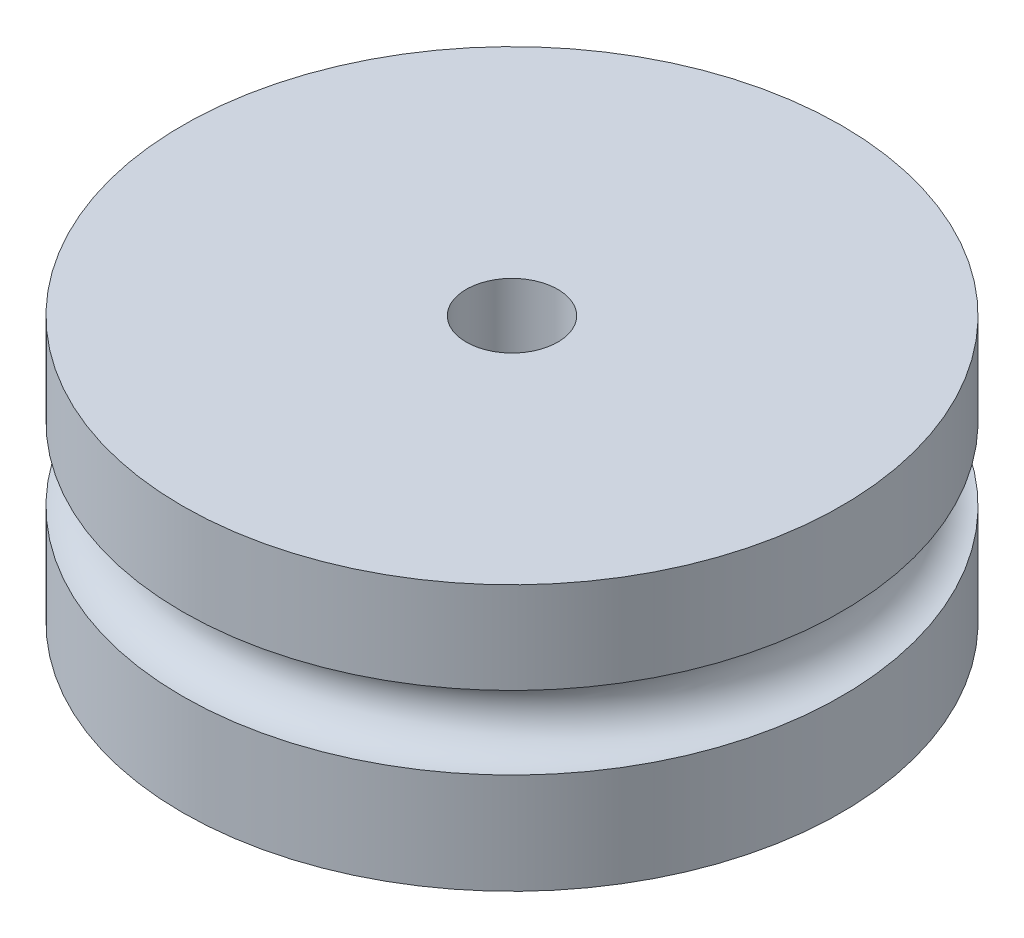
SolidWorks part; units mm, degrees
ref_plane "Front" through (0, 0, 0) normal (0, 0, 1) x (1, 0, 0)
ref_plane "Top" through (0, 0, 0) normal (0, 1, 0) x (1, 0, 0)
ref_plane "Right" through (0, 0, 0) normal (1, 0, 0) x (0, 0, -1)
sketch "Sketch1" plane through (0, 0, 0) normal (0, 1, 0) x (1, 0, 0)
  circle A0 centre (0, 0) radius 18
  dimension "D1" = 36
extrude "Boss-Extrude1" add sketch "Sketch1" along normal mid plane 14.5
sketch "Sketch2" plane through (0, 0, 0) normal (0, 0, 1) x (1, 0, 0)
  line L1 (-18, -7.25) -> (18, -7.25) construction
  line L2 (-18, 7.25) -> (-18, -7.25) construction
  circle A0 centre (-18, 0.25) radius 2
  dimension "D1" = 4
  dimension "D2" = 7.5
revolve "Cut-Revolve1" cut sketch "Sketch2" angle 360 about axis through (0, 7.25, 0) along (0, -1, 0)
hole_wizard "Ø5.0mm Dowel Hole1" positions "Sketch3" profile "Sketch4" hole size "Ø5.0" standard "ANSI Metric"
sketch "Sketch3" plane through (0, 7.25, 0) normal (0, 1, 0) x (1, 0, 0)
  point P0 (0, 0)
sketch "Sketch4" plane through (0, 7.25, 0) normal (1, 0, 0) x (0, 0, 1)
  line L0 (0, 0) -> (0, 14.5)
  line L1 (0, 14.5) -> (2.5, 14.5)
  line L2 (2.5, 14.5) -> (2.5, 0)
  line L5 (2.5, 0) -> (0, 0)
  line L11 (0, -6.35) -> (0, 107.95) construction
  dimension "Thru Hole Dia." = 5
  dimension "Thru Hole Depth" = 14.5
hole_wizard "M3x0.5 Tapped Hole1" positions "3DSketch1" profile "Sketch5" tap size "M3x0.5" standard "ANSI Metric"
sketch3d "3DSketch1"
  line L0 (0, 7.25, 0) -> (0, 2.25, 0) construction
  line L1 (0, 0, 0) -> (0, 4.75, 0) construction
  line L2 (0, 4.75, 0) -> (0, 4.75, 18) construction
  point P0 (0, 14.6251, 0)
  point P5 (0, 4.75, 18)
  dimension "D1" = 4.75
sketch "Sketch5" plane through (0, 4.75, 18) normal (1, 0, 0) x (0, -1, 0)
  line L0 (0, 0) -> (0, 18.7511)
  line L1 (0, 18.7511) -> (1.25, 18)
  line L2 (1.25, 18) -> (1.25, 0)
  line L5 (1.25, 0) -> (0, 0)
  line L10 (0, 18.7511) -> (-1.25, 18) construction
  line L11 (0, -6.35) -> (0, 107.95) construction
  dimension "Tap Drill Dia." = 2.5
  dimension "Tap Drill Depth" = 18
  dimension "Drill Angle" = 118
mirror "Mirror1" [suppressed] about plane through (0, 0, 0) normal (0, 1, 0)
hole_wizard "Ø5.0mm Dowel Hole2" positions "Sketch8" profile "Sketch7" hole size "Ø5.0" standard "ANSI Metric"
sketch "Sketch8" plane through (0, 7.25, 0) normal (0, 1, 0) x (1, 0, 0)
  point P0 (0, 0)
sketch "Sketch7" plane through (0, 7.25, 0) normal (1, 0, 0) x (0, 0, 1)
  line L0 (0, 0) -> (0, 14.5)
  line L1 (0, 14.5) -> (2.5, 14.5)
  line L2 (2.5, 14.5) -> (2.5, 0)
  line L5 (2.5, 0) -> (0, 0)
  line L11 (0, -6.35) -> (0, 107.95) construction
  dimension "Thru Hole Dia." = 5
  dimension "Thru Hole Depth" = 14.5
